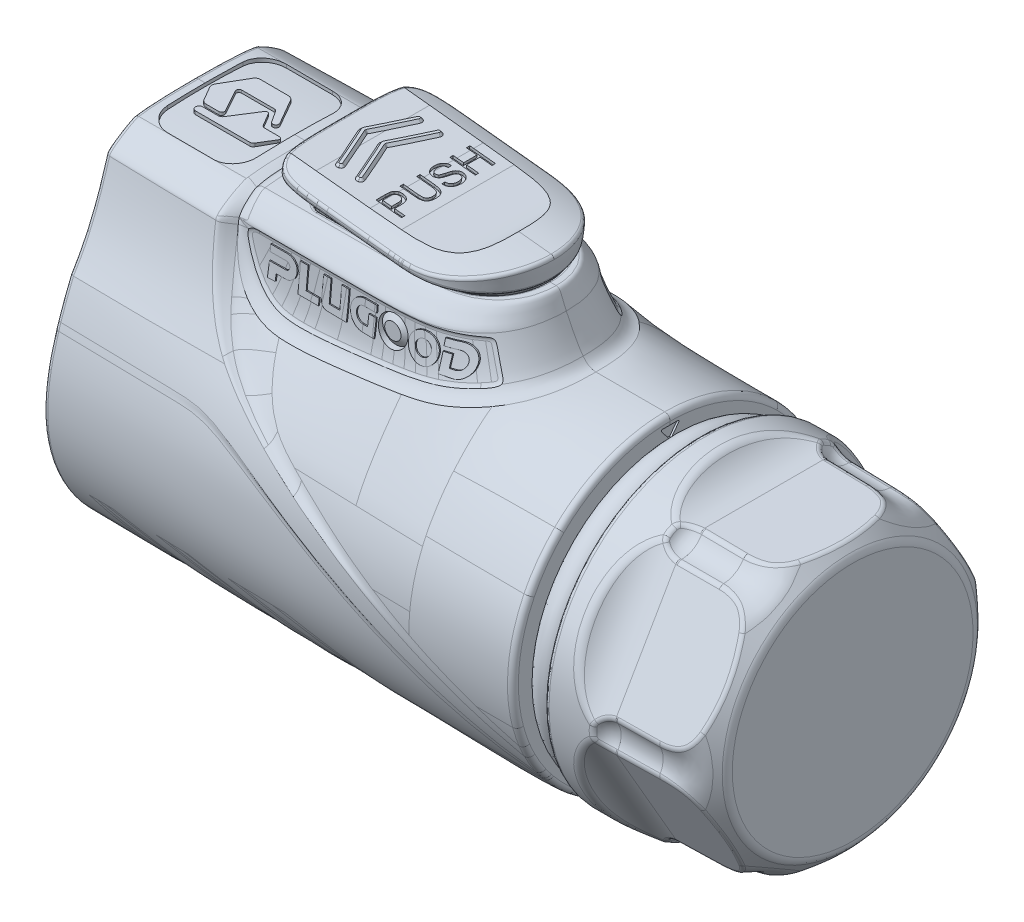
SolidWorks part; units mm, degrees
ref_plane "前视基准面" through (0, 0, 0) normal (0, 0, 1) x (1, 0, 0)
ref_plane "上视基准面" through (0, 0, 0) normal (0, 1, 0) x (1, 0, 0)
ref_plane "右视基准面" through (0, 0, 0) normal (1, 0, 0) x (0, 0, -1)
imported_body "PLG20 金属内牙-1-solid1"
imported_body "PLG20 4芯CD组件-1/PLG20 4芯D件-1-solid1"
imported_body "PLG20 4芯CD组件-1/PLG20 2.6焊接公铜针-1-solid1"
imported_body "PLG20 4芯CD组件-1/PLG20 2.6焊接公铜针-2-solid1"
imported_body "PLG20 4芯CD组件-1/PLG20 4芯C件-1-solid1"
imported_body "PLG20 4芯CD组件-1/PLG20 4芯模块防水垫片-1-solid1"
imported_body "PLG20 4芯CD组件-1/PLG20 2.6焊接公铜针-4-solid1"
imported_body "PLG20 4芯CD组件-1/PLG20 2.6焊接公铜针地线-2-solid1"
imported_body "PLG20 界面密封圈-1-solid1"
imported_body "PLG20 内牙端面密封垫_rev1-3-1-solid1"
imported_body "PLG20 塑胶尾部-1-solid1"
imported_body "PLG20 尾部夹线圈11.5mm -1-solid1"
imported_body "弹簧-1-solid1"
imported_body "PLG20外壳-LATEST-1-solid1"
imported_body "53505001_PLG20按扣_rev-1-solid1"
imported_body "PLG20 插销-1-solid1"
imported_body "PLG20插头螺帽-1-solid1"
imported_body "PLG20 色环-1-solid1"
sketch "草图1" plane through (0, 0, 0) normal (0, 0, 1) x (1, 0, 0)
  line L0 (0, 0) -> (62.1597, 0) construction
  line L1 (10.277, 0) -> (10.277, 9.1762)
  line L2 (10.277, 9.1762) -> (14.8226, 9.1762)
  line L3 (14.8226, 9.1762) -> (14.8226, 11.6201)
  line L4 (14.8226, 11.6201) -> (28.9485, 11.6201)
  line L5 (28.9485, 11.6201) -> (31.0799, 12.7932)
  line L6 (31.0799, 12.7932) -> (42.8299, 12.7932)
  line L7 (42.8299, 12.7932) -> (43.5631, 12.2067)
  line L8 (43.5631, 12.2067) -> (46.476, 12.2067)
  line L9 (46.476, 12.2067) -> (59.9, 11.0163)
  line L10 (59.9, 11.0163) -> (59.9, 0)
  line L11 (59.9, 0) -> (10.277, 0)
revolve "旋转1" add sketch "草图1" angle 360 about L0
sketch "草图2" plane through (0, 19.3424, 0) normal (0, -1, 0) x (1, 0, 0)
  circle A0 centre (19.5636, 0.0885) radius 2.5
extrude "凸台-拉伸1" add sketch "草图2" along normal blind 10
sketch "草图3" plane through (0, 0, 0) normal (0, 0, 1) x (1, 0, 0)
  circle A0 centre (25.036, 15.6733) radius 1.3007
extrude "凸台-拉伸2" add sketch "草图3" along normal mid plane 10
